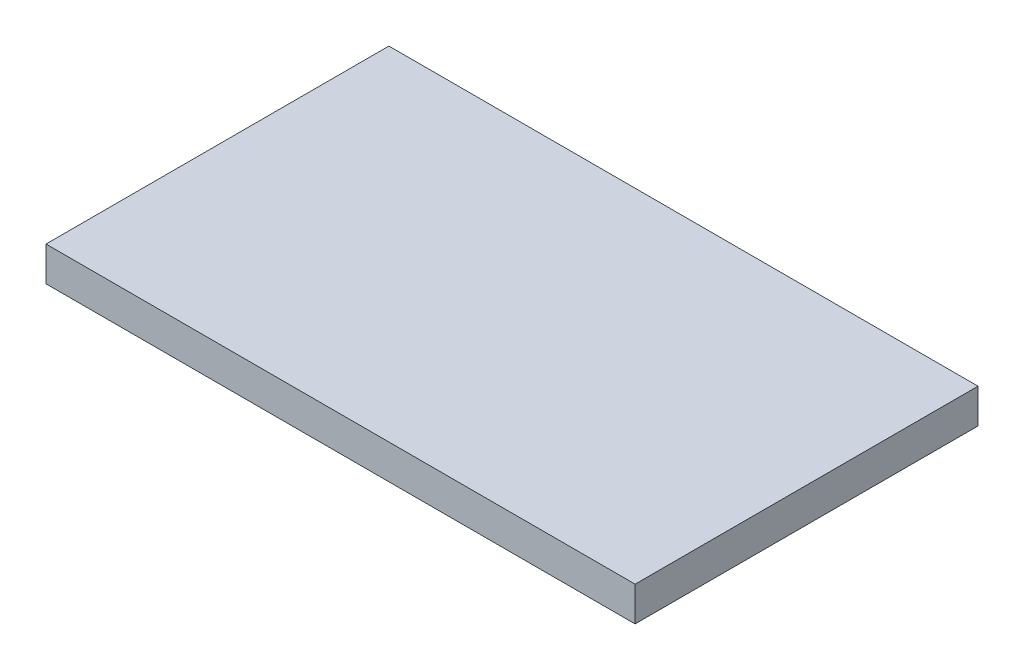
SolidWorks part; units mm, degrees
ref_plane "Front" through (0, 0, 0) normal (0, 0, 1) x (1, 0, 0)
ref_plane "Top" through (0, 0, 0) normal (0, 1, 0) x (1, 0, 0)
ref_plane "Right" through (0, 0, 0) normal (1, 0, 0) x (0, 0, -1)
sketch "Sketch1" plane through (0, 0, 0) normal (0, 1, 0) x (1, 0, 0)
  line L1 (-83.5956, 51.8031) -> (87.3359, 51.8031)
  line L2 (-83.5956, 51.8031) -> (-83.5956, -47.6888)
  line L3 (-83.5956, -47.6888) -> (87.3359, -47.6888)
  line L4 (87.3359, 51.8031) -> (87.3359, -47.6888)
extrude "Extrude1" add sketch "Sketch1" along normal blind 10
